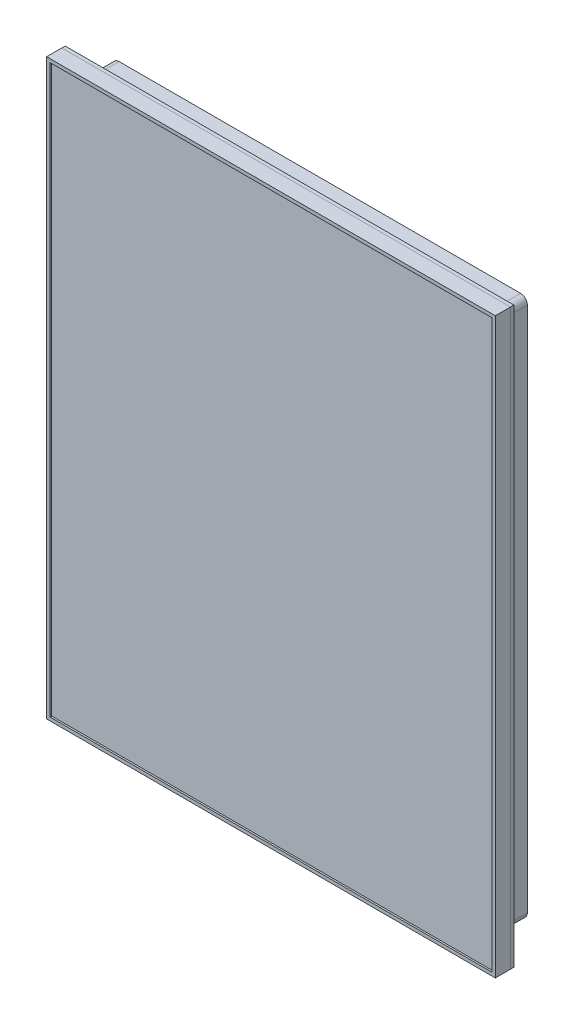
SolidWorks part; units mm, degrees
ref_plane "Front Plane" through (0, 0, 0) normal (0, 0, 1) x (1, 0, 0)
ref_plane "Top Plane" through (0, 0, 0) normal (0, 1, 0) x (1, 0, 0)
ref_plane "Right Plane" through (0, 0, 0) normal (1, 0, 0) x (0, 0, -1)
sketch "Esquisse1" plane through (0, 0, 0) normal (0, 0, 1) x (1, 0, 0)
  line L0 (-65.5, 75) -> (-65.5, -93)
  line L1 (-66.5, 76) -> (66.5, 76) construction
  line L2 (-66.5, 76) -> (-66.5, -94) construction
  line L3 (-66.5, -94) -> (66.5, -94) construction
  line L4 (66.5, 76) -> (66.5, -94) construction
  line L5 (-51.5, 61) -> (51.5, 61) construction
  line L6 (-51.5, 61) -> (-51.5, -61) construction
  line L7 (-51.5, -61) -> (51.5, -61) construction
  line L8 (51.5, 61) -> (51.5, -61) construction
  line L9 (-65.5, -93) -> (65.5, -93)
  line L10 (65.5, 75) -> (65.5, -93)
  line L11 (-65.5, 75) -> (65.5, 75)
  point P4 (0, 76)
  point P10 (-51.5, 0)
extrude "Verre" add sketch "Esquisse1" against normal blind 4
sketch "Esquisse2" plane through (0, 0, -4) normal (0, 0, -1) x (-1, 0, 0)
  line L1 (-66.5, 76) -> (66.5, 76)
  line L2 (-66.5, 76) -> (-66.5, -94)
  line L3 (-66.5, -94) -> (66.5, -94)
  line L4 (66.5, 76) -> (66.5, -94)
extrude "PlaqueFond" add sketch "Esquisse2" along normal blind 1 separate body
sketch "Esquisse10" plane through (0, 0, -4) normal (0, 0, 1) x (1, 0, 0)
  line L0 (66.5, -94) -> (-66.5, -94) construction
  line L1 (-66.5, 76) -> (66.5, 76)
  line L2 (-66.5, 76) -> (-66.5, -94)
  line L3 (-66.5, -94) -> (66.5, -94)
  line L4 (66.5, 76) -> (66.5, -94)
  line L5 (66.5, 76) -> (66.5, -94) construction
  line L6 (-65.5, 75) -> (-65.5, -93)
  line L7 (-65.5, -93) -> (65.5, -93)
  line L8 (65.5, 75) -> (65.5, -93)
  line L9 (-65.5, 75) -> (65.5, 75)
  dimension "D1" = 1
extrude "Bords" add sketch "Esquisse10" along normal blind 4.5 separate body
sketch "Esquisse3" plane through (0, 0, -5) normal (0, 0, -1) x (-1, 0, 0)
  line L0 (-66.5, 76) -> (-66.5, -94) construction
  line L1 (-61.5, 71) -> (61.5, 71)
  line L2 (-61.5, 71) -> (-61.5, -89)
  line L3 (-61.5, -89) -> (61.5, -89)
  line L4 (61.5, 71) -> (61.5, -89)
  line L5 (66.5, 76) -> (-66.5, 76) construction
  line L7 (-66.5, -94) -> (66.5, -94) construction
  point P8 (0, 71)
extrude "Fond" add sketch "Esquisse3" along normal blind 9 separate body
sketch "Esquisse4" plane through (0, 0, -4) normal (0, 0, 1) x (1, 0, 0)
  line L0 (-51.5, -61) -> (51.5, -61) construction
  line L1 (-44.5, 61) -> (44.5, 61)
  line L2 (-51.5, 54) -> (-51.5, -54)
  line L3 (-44.5, -61) -> (44.5, -61)
  line L4 (51.5, 54) -> (51.5, -54)
  line L5 (-51.5, 61) -> (-51.5, -61) construction
  line L6 (-51.5, 61) -> (51.5, 61) construction
  line L7 (51.5, 61) -> (51.5, -61) construction
  arc A0 (-44.5, 61) -> (-51.5, 54) centre (-44.5, 54) ccw
  arc A1 (44.5, 61) -> (51.5, 54) centre (44.5, 54) cw
  arc A2 (-51.5, -54) -> (-44.5, -61) centre (-44.5, -54) ccw
  arc A3 (44.5, -61) -> (51.5, -54) centre (44.5, -54) ccw
  dimension "D1" = 7
extrude "Reflecteur" cut sketch "Esquisse4" against normal blind 2
sketch "Esquisse5" plane through (0, 0, -6) normal (0, 0, 1) x (1, 0, 0)
  line L1 (-45.5, 46) -> (45.5, 46)
  line L2 (-45.5, 46) -> (-45.5, -46)
  line L3 (-45.5, -46) -> (45.5, -46)
  line L4 (45.5, 46) -> (45.5, -46)
  line L7 (-51.5, 61) -> (51.5, 61) construction
  line L8 (-51.5, 54) -> (-51.5, -54) construction
  point P4 (0, 46)
  point P6 (-45.5, 0)
  dimension "D1" = 6
  dimension "D2" = 15
extrude "Enlèv. mat.-Extru.2" cut sketch "Esquisse5" against normal blind 0.5
fillet "Congé1" radius 2 4 edges at (-61.5, -89, -9.5) (61.5, -89, -9.5) (-61.5, 71, -9.5) (61.5, 71, -9.5)
sketch "Esquisse6" plane through (0, -89, 0) normal (0, -1, 0) x (1, 0, 0)
  line L0 (-61.5, -14) -> (-61.5, -5) construction
  circle A0 centre (0, -9.5) radius 1.5
  point P7 (-61.5, -9.5)
  dimension "D1" = 3
sketch "Esquisse9" plane through (0, 0, 0) normal (0, 0, 1) x (1, 0, 0)
  line L0 (-1.5, -89) -> (1.5, -89) construction
  line L1 (0, -70.8222) -> (0, -94.4985) construction
  line L2 (-55.9568, -89.2163) -> (-83.9609, -89.2163) construction
  line L3 (-15.1418, -89.2163) -> (-69.2068, -89.2163)
  spline S0 degree 3 poles (-15.1418, -89.2163) (-3.8689, -89.2163) (0, -96.7763) (0, -89) knots 0 0 0 0 1 1 1 1
sweep "Balayage1" add profiles "Esquisse6" path "Esquisse9"
equation "\"D4@Esquisse1\"=\"D3@Esquisse1\""
equation "\"D5@Esquisse1\"=\"D3@Esquisse1\""
equation "\"D2@Esquisse3\"=\"D1@Esquisse3\""
equation "\"D3@Esquisse3\"=\"D1@Esquisse3\""
